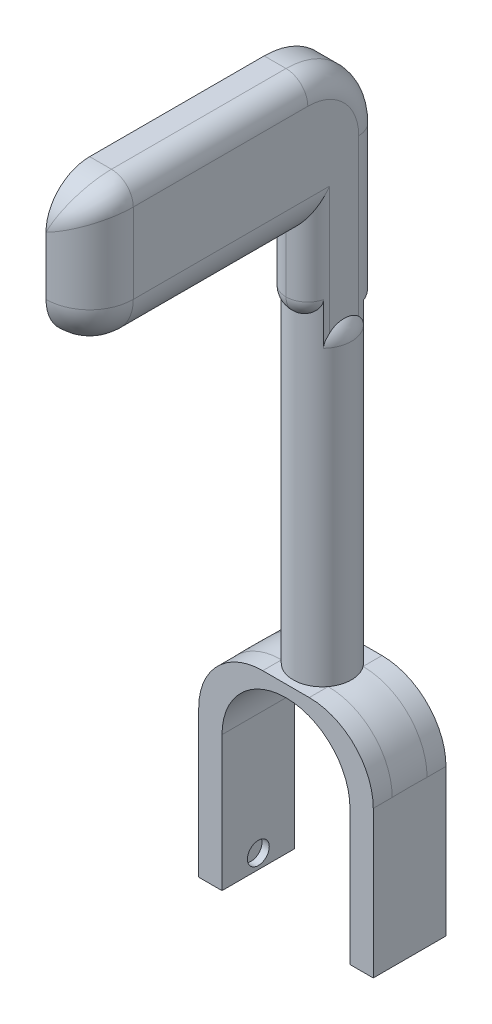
SolidWorks part; units mm, degrees
ref_plane "Front Plane" through (0, 0, 0) normal (0, 0, 1) x (1, 0, 0)
ref_plane "Top Plane" through (0, 0, 0) normal (0, 1, 0) x (1, 0, 0)
ref_plane "Right Plane" through (0, 0, 0) normal (1, 0, 0) x (0, 0, -1)
sketch "Sketch1" plane through (0, 0, 0) normal (0, 1, 0) x (1, 0, 0)
  circle A0 centre (0, 0) radius 5.08
  dimension "D1" = 10.16
extrude "Boss-Extrude1" add sketch "Sketch1" along normal blind 55.0062
sketch "Sketch2" plane through (0, 0, 0) normal (0, -1, 0) x (-1, 0, 0)
  line L1 (15.24, 6.35) -> (-15.24, 6.35)
  line L2 (15.24, 6.35) -> (15.24, -6.35)
  line L3 (15.24, -6.35) -> (-15.24, -6.35)
  line L4 (-15.24, 6.35) -> (-15.24, -6.35)
  line L5 (15.24, 6.35) -> (-15.24, -6.35) construction
  line L6 (15.24, -6.35) -> (-15.24, 6.35) construction
  point P0 (0, 0)
  dimension "D1" = 30.48
  dimension "D2" = 12.7
extrude "Boss-Extrude2" add sketch "Sketch2" along normal blind 36.83
sketch "Sketch5" plane through (0, 0, 6.35) normal (0, 0, 1) x (1, 0, 0)
  line L0 (15.24, -36.83) -> (-15.24, -36.83) construction
  line L1 (-11.176, -36.83) -> (11.176, -36.83)
  line L2 (-11.176, -36.83) -> (-11.176, -13.2334)
  line L3 (-11.176, -13.2334) -> (11.176, -13.2334)
  line L4 (11.176, -36.83) -> (11.176, -13.2334)
  line L5 (15.24, -36.83) -> (15.24, 0) construction
  arc A0 (-11.176, -13.2334) -> (11.176, -13.2334) centre (0, -13.2334) cw
  dimension "D3" = 23.5966
  dimension "D1" = 22.352
  dimension "D2" = 15.24
extrude "Cut-Extrude1" cut sketch "Sketch5" against normal through all contours L4 L3 L2 M8 | A0 L3
sketch "Sketch6" plane through (-11.176, 0, 0) normal (1, 0, 0) x (0, 0, -1)
  line L0 (6.35, -36.83) -> (6.35, -13.2334) construction
  line L1 (-6.35, 0) -> (6.35, 0) construction
  circle A0 centre (0, -34.29) radius 1.905
  dimension "D1" = 3.81
  dimension "D2" = 34.29
  dimension "D3" = 6.35
fillet "Fillet1" radius 11.176 1 edges at (15.24, 0, 0)
fillet "Fillet2" radius 11.176 1 edges at (-15.24, 0, 0)
sketch "Sketch8" plane through (0, 55.0062, 0) normal (0, 1, 0) x (1, 0, 0)
  line L1 (-3.81, -6.35) -> (3.81, -6.35)
  line L2 (-3.81, -6.35) -> (-3.81, 6.35)
  line L3 (-3.81, 6.35) -> (3.81, 6.35)
  line L4 (3.81, -6.35) -> (3.81, 6.35)
  line L5 (-3.81, -6.35) -> (3.81, 6.35) construction
  line L6 (-3.81, 6.35) -> (3.81, -6.35) construction
  point P0 (0, 0)
  dimension "D1" = 7.62
  dimension "D2" = 12.7
extrude "Boss-Extrude5" add sketch "Sketch8" along normal blind 38.1
sketch "Sketch9" plane through (0, 0, 6.35) normal (0, 0, 1) x (1, 0, 0)
  line L0 (3.81, 93.1062) -> (3.81, 55.0062) construction
  line L1 (-3.81, 93.1062) -> (3.81, 93.1062)
  line L2 (-3.81, 93.1062) -> (-3.81, 67.7062)
  line L3 (-3.81, 67.7062) -> (3.81, 67.7062)
  line L4 (3.81, 93.1062) -> (3.81, 67.7062)
  dimension "D1" = 25.4
extrude "Boss-Extrude6" add sketch "Sketch9" along normal blind 38.1
fillet "Fillet3" [suppressed] radius 12.7
fillet "Fillet5" radius 3.81 1 edges at (3.81, 61.3562, 6.35)
fillet "Fillet6" radius 3.81 1 edges at (-3.81, 61.3562, 6.35)
fillet "Fillet7" radius 3.81 1 edges at (-5.0792, 55.0062, 0.0897)
fillet "Fillet8" radius 3.81 1 edges at (5.0792, 55.0062, 0.0897)
fillet "Fillet16" radius 12.7 1 edges at (0, 93.1062, -6.35)
fillet "Fillet18" radius 3.81 3 edges at (3.81, 93.1062, 25.4) (3.81, 89.3865, -2.6303) (3.81, 67.7062, -6.35)
fillet "Fillet20" radius 7.62 3 edges at (-1.905, 93.1062, 44.45) (2.6941, 91.9903, 44.45) (3.81, 78.5012, 44.45)
fillet "Fillet21" radius 7.62 2 edges at (1.5782, 67.7062, 42.2182) (3.81, 67.7062, 19.685)
fillet "Fillet22" radius 3.556 3 edges at (-1.905, 55.0062, -6.35) (-2.3331, 55.0062, 5.5521) (2.3331, 55.0062, 5.5521)
extrude "Cut-Extrude2" cut sketch "Sketch6" against normal blind 1.27
sketch "Sketch10" plane through (11.176, 0, 0) normal (-1, 0, 0) x (0, 0, 1)
  line L0 (-6.35, -36.83) -> (-6.35, -13.2334) construction
  line L1 (-3.048, 0) -> (-5.08, 0) construction
  circle A0 centre (0, -34.29) radius 1.905
  dimension "D1" = 3.81
  dimension "D2" = 6.35
  dimension "D3" = 34.29
extrude "Cut-Extrude3" cut sketch "Sketch10" against normal blind 1.27
